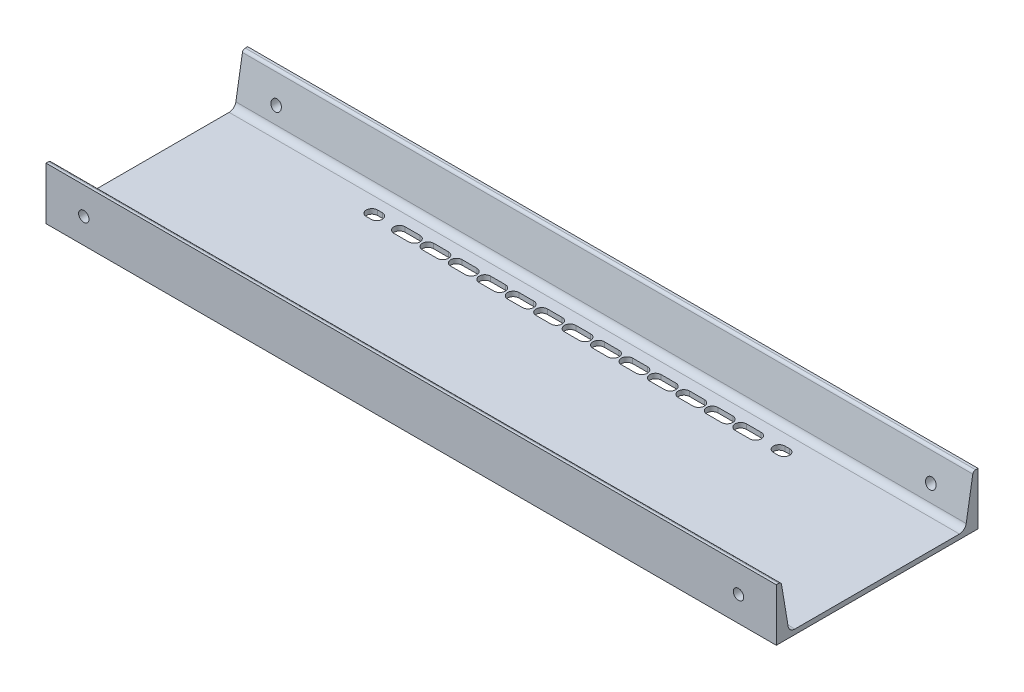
SolidWorks part; units mm, degrees
ref_plane "Front Plane" through (0, 0, 0) normal (1, 0, 0) x (0, 1, 0)
ref_plane "Top Plane" through (0, 0, 0) normal (0, 0, 1) x (0, 1, 0)
ref_plane "Right Plane" through (0, 0, 0) normal (0, 1, 0) x (-1, 0, 0)
sketch "sk0 C10 x 15.3" plane through (0, 0, 0) normal (1, 0, 0) x (0, 1, 0)
  point P0 (-16.0851, 127)
  line B0 (-16.0851, -127) -> (-16.0851, 127)
  line B1 (-16.0851, 127) -> (49.9549, 127)
  line B2 (-16.0851, -127) -> (49.9549, -127)
  line B3 (-16.0851, 0) -> (0, 0) construction
  line B4 (-9.9891, 103.6142) -> (-9.9891, -103.6142)
  line B5 (49.9549, 127) -> (49.9549, 123.9336)
  line B6 (49.9549, -127) -> (49.9549, -123.9336)
  line B7 (-2.7729, 112.1327) -> (46.9836, 120.426)
  line B8 (-2.7729, -112.1327) -> (46.9836, -120.426)
  arc B9 (-9.9891, -103.6142) -> (-2.7729, -112.1327) centre (-1.3531, -103.6142) ccw
  arc B10 (-9.9891, 103.6142) -> (-2.7729, 112.1327) centre (-1.3531, 103.6142) cw
  arc B11 (49.9549, 123.9336) -> (46.9836, 120.426) centre (46.3989, 123.9336) cw
  arc B12 (49.9549, -123.9336) -> (46.9836, -120.426) centre (46.3989, -123.9336) ccw
sketch_block_instance "C10 x 15.3-4"
sketch_block "C10 x 15.3" parameters "D3"=8.636, "D6"=3.556, "D1"=254, "D2"=66.04, "D4"=6.096, "D5"=9.463, "D7"=3.0664, "D8"=16.0851
sketch "sk2 C10 x 15.3" plane through (0, 0, 0) normal (1, 0, 0) x (0, 1, 0)
  line B0 (-16.0851, -127) -> (-16.0851, 127)
  line B1 (-16.0851, 127) -> (49.9549, 127)
  line B2 (-16.0851, -127) -> (49.9549, -127)
  line B3 (-16.0851, 0) -> (0, 0) construction
  line B4 (-9.9891, 103.6142) -> (-9.9891, -103.6142)
  line B5 (49.9549, 127) -> (49.9549, 123.9336)
  line B6 (49.9549, -127) -> (49.9549, -123.9336)
  line B7 (-2.7729, 112.1327) -> (46.9836, 120.426)
  line B8 (-2.7729, -112.1327) -> (46.9836, -120.426)
  arc B9 (-9.9891, -103.6142) -> (-2.7729, -112.1327) centre (-1.3531, -103.6142) ccw
  arc B10 (-9.9891, 103.6142) -> (-2.7729, 112.1327) centre (-1.3531, 103.6142) cw
  arc B11 (49.9549, 123.9336) -> (46.9836, 120.426) centre (46.3989, 123.9336) cw
  arc B12 (49.9549, -123.9336) -> (46.9836, -120.426) centre (46.3989, -123.9336) ccw
sketch_block_instance "C10 x 15.3-3"
sketch "sk C10 x 15.3" plane through (0, 0, 0) normal (1, 0, 0) x (0, 1, 0)
  line B0 (-16.0851, -127) -> (-16.0851, 127)
  line B1 (-16.0851, 127) -> (49.9549, 127)
  line B2 (-16.0851, -127) -> (49.9549, -127)
  line B3 (-16.0851, 0) -> (0, 0) construction
  line B4 (-9.9891, 103.6142) -> (-9.9891, -103.6142)
  line B5 (49.9549, 127) -> (49.9549, 123.9336)
  line B6 (49.9549, -127) -> (49.9549, -123.9336)
  line B7 (-2.7729, 112.1327) -> (46.9836, 120.426)
  line B8 (-2.7729, -112.1327) -> (46.9836, -120.426)
  arc B9 (-9.9891, -103.6142) -> (-2.7729, -112.1327) centre (-1.3531, -103.6142) ccw
  arc B10 (-9.9891, 103.6142) -> (-2.7729, 112.1327) centre (-1.3531, 103.6142) cw
  arc B11 (49.9549, 123.9336) -> (46.9836, 120.426) centre (46.3989, 123.9336) cw
  arc B12 (49.9549, -123.9336) -> (46.9836, -120.426) centre (46.3989, -123.9336) ccw
sketch_block_instance "C10 x 15.3-2"
sketch "sk Bolt pat" plane through (0, 0, 0) normal (0, 1, 0) x (-1, 0, 0)
  line L0 (0, -82.55) -> (0, 82.55) construction
  point P2 (0, 0)
  circle B0 centre (0, -82.55) radius 7.1438
  circle B1 centre (0, 82.55) radius 7.1438
sketch_block_instance "Bolt pat-1"
sketch_block "Bolt pat" parameters "D1"=19.0707, "D2"=20.4939
sketch "sk Bolt Pattern North South" plane through (0, 0, 0) normal (0, 1, 0) x (-1, 0, 0)
  line B0 (-4.6, 82.55) -> (4.6, 82.55) construction
  line B1 (315.0083, 89.6937) -> (321.0083, 89.6937)
  line B2 (315.0083, 75.4063) -> (321.0083, 75.4063)
  line B3 (266.672, 89.6938) -> (275.872, 89.6938)
  line B4 (266.672, 75.4063) -> (275.872, 75.4063)
  line B5 (221.46, 89.6938) -> (230.66, 89.6938)
  line B6 (221.46, 75.4063) -> (230.66, 75.4063)
  line B7 (176.248, 89.6938) -> (185.448, 89.6938)
  line B8 (176.248, 75.4063) -> (185.448, 75.4063)
  line B9 (131.036, 89.6938) -> (140.236, 89.6938)
  line B10 (131.036, 75.4063) -> (140.236, 75.4063)
  line B11 (85.824, 89.6938) -> (95.024, 89.6938)
  line B12 (85.824, 75.4063) -> (95.024, 75.4063)
  line B13 (40.612, 89.6938) -> (49.812, 89.6938)
  line B14 (40.612, 75.4063) -> (49.812, 75.4063)
  line B15 (-4.6, 89.6938) -> (4.6, 89.6938)
  line B16 (-4.6, 75.4062) -> (4.6, 75.4062)
  line B17 (-49.812, 89.6938) -> (-40.612, 89.6938)
  line B18 (-49.812, 75.4062) -> (-40.612, 75.4062)
  line B19 (-95.024, 89.6938) -> (-85.824, 89.6938)
  line B20 (-95.024, 75.4062) -> (-85.824, 75.4062)
  line B21 (-140.236, 89.6938) -> (-131.036, 89.6938)
  line B22 (-140.236, 75.4062) -> (-131.036, 75.4062)
  line B23 (-185.448, 89.6938) -> (-176.248, 89.6938)
  line B24 (-185.448, 75.4062) -> (-176.248, 75.4062)
  line B25 (-230.66, 89.6938) -> (-221.46, 89.6938)
  line B26 (-230.66, 75.4062) -> (-221.46, 75.4062)
  line B27 (-275.872, 89.6937) -> (-266.672, 89.6937)
  line B28 (-275.872, 75.4062) -> (-266.672, 75.4062)
  line B29 (-321.0083, 89.6938) -> (-315.0083, 89.6938)
  line B30 (-321.0083, 75.4063) -> (-315.0083, 75.4063)
  arc B31 (315.0083, 89.6937) -> (315.0083, 75.4063) centre (315.0083, 82.55) ccw
  arc B32 (321.0083, 75.4063) -> (321.0083, 89.6937) centre (321.0083, 82.55) ccw
  arc B33 (266.672, 89.6938) -> (266.672, 75.4063) centre (266.672, 82.55) ccw
  arc B34 (275.872, 75.4063) -> (275.872, 89.6938) centre (275.872, 82.55) ccw
  arc B35 (221.46, 89.6938) -> (221.46, 75.4063) centre (221.46, 82.55) ccw
  arc B36 (230.66, 75.4063) -> (230.66, 89.6938) centre (230.66, 82.55) ccw
  arc B37 (176.248, 89.6938) -> (176.248, 75.4063) centre (176.248, 82.55) ccw
  arc B38 (185.448, 75.4063) -> (185.448, 89.6938) centre (185.448, 82.55) ccw
  arc B39 (131.036, 89.6938) -> (131.036, 75.4063) centre (131.036, 82.55) ccw
  arc B40 (140.236, 75.4063) -> (140.236, 89.6938) centre (140.236, 82.55) ccw
  arc B41 (85.824, 89.6938) -> (85.824, 75.4063) centre (85.824, 82.55) ccw
  arc B42 (95.024, 75.4063) -> (95.024, 89.6938) centre (95.024, 82.55) ccw
  arc B43 (40.612, 89.6938) -> (40.612, 75.4063) centre (40.612, 82.55) ccw
  arc B44 (49.812, 75.4063) -> (49.812, 89.6938) centre (49.812, 82.55) ccw
  arc B45 (-4.6, 89.6938) -> (-4.6, 75.4062) centre (-4.6, 82.55) ccw
  arc B46 (4.6, 75.4062) -> (4.6, 89.6938) centre (4.6, 82.55) ccw
  arc B47 (-49.812, 89.6938) -> (-49.812, 75.4062) centre (-49.812, 82.55) ccw
  arc B48 (-40.612, 75.4062) -> (-40.612, 89.6938) centre (-40.612, 82.55) ccw
  arc B49 (-95.024, 89.6938) -> (-95.024, 75.4062) centre (-95.024, 82.55) ccw
  arc B50 (-85.824, 75.4062) -> (-85.824, 89.6938) centre (-85.824, 82.55) ccw
  arc B51 (-140.236, 89.6938) -> (-140.236, 75.4062) centre (-140.236, 82.55) ccw
  arc B52 (-131.036, 75.4062) -> (-131.036, 89.6938) centre (-131.036, 82.55) ccw
  arc B53 (-185.448, 89.6938) -> (-185.448, 75.4062) centre (-185.448, 82.55) ccw
  arc B54 (-176.248, 75.4062) -> (-176.248, 89.6938) centre (-176.248, 82.55) ccw
  arc B55 (-230.66, 89.6938) -> (-230.66, 75.4062) centre (-230.66, 82.55) ccw
  arc B56 (-221.46, 75.4062) -> (-221.46, 89.6938) centre (-221.46, 82.55) ccw
  arc B57 (-275.872, 89.6937) -> (-275.872, 75.4062) centre (-275.872, 82.55) ccw
  arc B58 (-266.672, 75.4062) -> (-266.672, 89.6937) centre (-266.672, 82.55) ccw
  arc B59 (-321.0083, 89.6938) -> (-321.0083, 75.4063) centre (-321.0083, 82.55) ccw
  arc B60 (-315.0083, 75.4063) -> (-315.0083, 89.6938) centre (-315.0083, 82.55) ccw
  line B61 (-4.6, -82.55) -> (4.6, -82.55) construction
  line B62 (315.0083, -75.4063) -> (321.0083, -75.4063)
  line B63 (315.0083, -89.6937) -> (321.0083, -89.6937)
  line B64 (266.672, -75.4062) -> (275.872, -75.4062)
  line B65 (266.672, -89.6937) -> (275.872, -89.6937)
  line B66 (221.46, -75.4062) -> (230.66, -75.4062)
  line B67 (221.46, -89.6937) -> (230.66, -89.6937)
  line B68 (176.248, -75.4062) -> (185.448, -75.4062)
  line B69 (176.248, -89.6937) -> (185.448, -89.6937)
  line B70 (131.036, -75.4062) -> (140.236, -75.4062)
  line B71 (131.036, -89.6937) -> (140.236, -89.6937)
  line B72 (85.824, -75.4062) -> (95.024, -75.4062)
  line B73 (85.824, -89.6937) -> (95.024, -89.6937)
  line B74 (40.612, -75.4062) -> (49.812, -75.4062)
  line B75 (40.612, -89.6937) -> (49.812, -89.6937)
  line B76 (-4.6, -75.4062) -> (4.6, -75.4062)
  line B77 (-4.6, -89.6938) -> (4.6, -89.6938)
  line B78 (-49.812, -75.4062) -> (-40.612, -75.4062)
  line B79 (-49.812, -89.6938) -> (-40.612, -89.6938)
  line B80 (-95.024, -75.4062) -> (-85.824, -75.4062)
  line B81 (-95.024, -89.6938) -> (-85.824, -89.6938)
  line B82 (-140.236, -75.4062) -> (-131.036, -75.4062)
  line B83 (-140.236, -89.6938) -> (-131.036, -89.6938)
  line B84 (-185.448, -75.4062) -> (-176.248, -75.4062)
  line B85 (-185.448, -89.6938) -> (-176.248, -89.6938)
  line B86 (-230.66, -75.4062) -> (-221.46, -75.4062)
  line B87 (-230.66, -89.6938) -> (-221.46, -89.6938)
  line B88 (-275.872, -75.4063) -> (-266.672, -75.4063)
  line B89 (-275.872, -89.6938) -> (-266.672, -89.6938)
  line B90 (-321.0083, -75.4062) -> (-315.0083, -75.4062)
  line B91 (-321.0083, -89.6937) -> (-315.0083, -89.6937)
  arc B92 (315.0083, -75.4063) -> (315.0083, -89.6937) centre (315.0083, -82.55) ccw
  arc B93 (321.0083, -89.6937) -> (321.0083, -75.4063) centre (321.0083, -82.55) ccw
  arc B94 (266.672, -75.4062) -> (266.672, -89.6937) centre (266.672, -82.55) ccw
  arc B95 (275.872, -89.6937) -> (275.872, -75.4062) centre (275.872, -82.55) ccw
  arc B96 (221.46, -75.4062) -> (221.46, -89.6937) centre (221.46, -82.55) ccw
  arc B97 (230.66, -89.6937) -> (230.66, -75.4062) centre (230.66, -82.55) ccw
  arc B98 (176.248, -75.4062) -> (176.248, -89.6937) centre (176.248, -82.55) ccw
  arc B99 (185.448, -89.6937) -> (185.448, -75.4062) centre (185.448, -82.55) ccw
  arc B100 (131.036, -75.4062) -> (131.036, -89.6937) centre (131.036, -82.55) ccw
  arc B101 (140.236, -89.6937) -> (140.236, -75.4062) centre (140.236, -82.55) ccw
  arc B102 (85.824, -75.4062) -> (85.824, -89.6937) centre (85.824, -82.55) ccw
  arc B103 (95.024, -89.6937) -> (95.024, -75.4062) centre (95.024, -82.55) ccw
  arc B104 (40.612, -75.4062) -> (40.612, -89.6937) centre (40.612, -82.55) ccw
  arc B105 (49.812, -89.6937) -> (49.812, -75.4062) centre (49.812, -82.55) ccw
  arc B106 (-4.6, -75.4062) -> (-4.6, -89.6938) centre (-4.6, -82.55) ccw
  arc B107 (4.6, -89.6938) -> (4.6, -75.4062) centre (4.6, -82.55) ccw
  arc B108 (-49.812, -75.4062) -> (-49.812, -89.6938) centre (-49.812, -82.55) ccw
  arc B109 (-40.612, -89.6938) -> (-40.612, -75.4062) centre (-40.612, -82.55) ccw
  arc B110 (-95.024, -75.4062) -> (-95.024, -89.6938) centre (-95.024, -82.55) ccw
  arc B111 (-85.824, -89.6938) -> (-85.824, -75.4062) centre (-85.824, -82.55) ccw
  arc B112 (-140.236, -75.4062) -> (-140.236, -89.6938) centre (-140.236, -82.55) ccw
  arc B113 (-131.036, -89.6938) -> (-131.036, -75.4062) centre (-131.036, -82.55) ccw
  arc B114 (-185.448, -75.4062) -> (-185.448, -89.6938) centre (-185.448, -82.55) ccw
  arc B115 (-176.248, -89.6938) -> (-176.248, -75.4062) centre (-176.248, -82.55) ccw
  arc B116 (-230.66, -75.4062) -> (-230.66, -89.6938) centre (-230.66, -82.55) ccw
  arc B117 (-221.46, -89.6938) -> (-221.46, -75.4062) centre (-221.46, -82.55) ccw
  arc B118 (-275.872, -75.4063) -> (-275.872, -89.6938) centre (-275.872, -82.55) ccw
  arc B119 (-266.672, -89.6938) -> (-266.672, -75.4063) centre (-266.672, -82.55) ccw
  arc B120 (-321.0083, -75.4062) -> (-321.0083, -89.6937) centre (-321.0083, -82.55) ccw
  arc B121 (-315.0083, -89.6937) -> (-315.0083, -75.4062) centre (-315.0083, -82.55) ccw
sketch_block_instance "Bolt Pattern North South-1"
sketch_block "Bolt Pattern North South" parameters "D1"=7.1437, "D4"=7.1437, "D2"=6, "D3"=9.2, "D5"=6
sketch_block_instance "Bolt Pattern North South-2"
sketch "sk Bolt Pattern East West" plane through (0, 0, 0) normal (0, 1, 0) x (-1, 0, 0)
  line B0 (-9.3, 82.55) -> (9.3, 82.55) construction
  arc B1 (-253.9215, 75.4063) -> (-253.9215, 89.6937) centre (-253.9215, 82.55) ccw
  line B2 (-259.9215, 89.6937) -> (-253.9215, 89.6937)
  line B3 (-259.9215, 75.4063) -> (-253.9215, 75.4063)
  line B4 (253.9215, 88.7273) -> (259.9215, 88.7273)
  line B5 (253.9215, 74.4398) -> (259.9215, 74.4398)
  line B6 (-224.184, 89.6937) -> (-205.584, 89.6937)
  line B7 (-224.184, 75.4063) -> (-205.584, 75.4063)
  line B8 (-188.37, 89.6937) -> (-169.77, 89.6937)
  line B9 (-188.37, 75.4063) -> (-169.77, 75.4063)
  line B10 (-152.556, 89.6937) -> (-133.956, 89.6937)
  line B11 (-152.556, 75.4063) -> (-133.956, 75.4063)
  line B12 (-116.742, 82.55) -> (-98.142, 82.55) construction
  line B13 (-116.742, 89.6937) -> (-98.142, 89.6937)
  line B14 (-116.742, 75.4063) -> (-98.142, 75.4063)
  line B15 (-80.928, 89.6937) -> (-62.328, 89.6937)
  line B16 (-80.928, 75.4063) -> (-62.328, 75.4063)
  line B17 (-45.114, 89.6937) -> (-26.514, 89.6937)
  line B18 (-45.114, 75.4063) -> (-26.514, 75.4063)
  line B19 (-9.3, 89.6937) -> (9.3, 89.6937)
  line B20 (-9.3, 75.4063) -> (9.3, 75.4063)
  line B21 (26.514, 89.6937) -> (45.114, 89.6937)
  line B22 (26.514, 75.4063) -> (45.114, 75.4063)
  line B23 (62.328, 89.6937) -> (80.928, 89.6937)
  line B24 (62.328, 75.4063) -> (80.928, 75.4063)
  line B25 (98.142, 89.6937) -> (116.742, 89.6937)
  line B26 (98.142, 75.4063) -> (116.742, 75.4063)
  line B27 (133.956, 89.6937) -> (152.556, 89.6937)
  line B28 (133.956, 75.4063) -> (152.556, 75.4063)
  line B29 (169.77, 89.6937) -> (188.37, 89.6937)
  line B30 (169.77, 75.4063) -> (188.37, 75.4063)
  line B31 (205.584, 89.6937) -> (224.184, 89.6937)
  line B32 (205.584, 75.4063) -> (224.184, 75.4063)
  arc B33 (-259.9215, 89.6937) -> (-259.9215, 75.4063) centre (-259.9215, 82.55) ccw
  arc B34 (253.9215, 88.7273) -> (253.9215, 74.4398) centre (253.9215, 81.5836) ccw
  arc B35 (259.9215, 74.4398) -> (259.9215, 88.7273) centre (259.9215, 81.5836) ccw
  arc B36 (-224.184, 89.6937) -> (-224.184, 75.4063) centre (-224.184, 82.55) ccw
  arc B37 (-205.584, 75.4063) -> (-205.584, 89.6937) centre (-205.584, 82.55) ccw
  arc B38 (-188.37, 89.6937) -> (-188.37, 75.4063) centre (-188.37, 82.55) ccw
  arc B39 (-169.77, 75.4063) -> (-169.77, 89.6937) centre (-169.77, 82.55) ccw
  arc B40 (-152.556, 89.6937) -> (-152.556, 75.4063) centre (-152.556, 82.55) ccw
  arc B41 (-133.956, 75.4063) -> (-133.956, 89.6937) centre (-133.956, 82.55) ccw
  arc B42 (-116.742, 89.6937) -> (-116.742, 75.4063) centre (-116.742, 82.55) ccw
  arc B43 (-98.142, 75.4063) -> (-98.142, 89.6937) centre (-98.142, 82.55) ccw
  arc B44 (-80.928, 89.6937) -> (-80.928, 75.4063) centre (-80.928, 82.55) ccw
  arc B45 (-62.328, 75.4063) -> (-62.328, 89.6937) centre (-62.328, 82.55) ccw
  arc B46 (-45.114, 89.6937) -> (-45.114, 75.4063) centre (-45.114, 82.55) ccw
  arc B47 (-26.514, 75.4063) -> (-26.514, 89.6937) centre (-26.514, 82.55) ccw
  arc B48 (-9.3, 89.6937) -> (-9.3, 75.4063) centre (-9.3, 82.55) ccw
  arc B49 (9.3, 75.4063) -> (9.3, 89.6937) centre (9.3, 82.55) ccw
  arc B50 (26.514, 89.6937) -> (26.514, 75.4063) centre (26.514, 82.55) ccw
  arc B51 (45.114, 75.4063) -> (45.114, 89.6937) centre (45.114, 82.55) ccw
  arc B52 (62.328, 89.6937) -> (62.328, 75.4063) centre (62.328, 82.55) ccw
  arc B53 (80.928, 75.4063) -> (80.928, 89.6937) centre (80.928, 82.55) ccw
  arc B54 (98.142, 89.6937) -> (98.142, 75.4063) centre (98.142, 82.55) ccw
  arc B55 (116.742, 75.4063) -> (116.742, 89.6937) centre (116.742, 82.55) ccw
  arc B56 (133.956, 89.6937) -> (133.956, 75.4063) centre (133.956, 82.55) ccw
  arc B57 (152.556, 75.4063) -> (152.556, 89.6937) centre (152.556, 82.55) ccw
  arc B58 (169.77, 89.6937) -> (169.77, 75.4063) centre (169.77, 82.55) ccw
  arc B59 (188.37, 75.4063) -> (188.37, 89.6937) centre (188.37, 82.55) ccw
  arc B60 (205.584, 89.6937) -> (205.584, 75.4063) centre (205.584, 82.55) ccw
  arc B61 (224.184, 75.4063) -> (224.184, 89.6937) centre (224.184, 82.55) ccw
  line B62 (-9.3, -82.55) -> (9.3, -82.55) construction
  arc B63 (-253.9215, -89.6937) -> (-253.9215, -75.4063) centre (-253.9215, -82.55) ccw
  line B64 (-259.9215, -75.4063) -> (-253.9215, -75.4063)
  line B65 (-259.9215, -89.6937) -> (-253.9215, -89.6937)
  line B66 (253.9215, -76.3727) -> (259.9215, -76.3727)
  line B67 (253.9215, -90.6602) -> (259.9215, -90.6602)
  line B68 (-224.184, -75.4063) -> (-205.584, -75.4063)
  line B69 (-224.184, -89.6937) -> (-205.584, -89.6937)
  line B70 (-188.37, -75.4063) -> (-169.77, -75.4063)
  line B71 (-188.37, -89.6937) -> (-169.77, -89.6937)
  line B72 (-152.556, -75.4063) -> (-133.956, -75.4063)
  line B73 (-152.556, -89.6937) -> (-133.956, -89.6937)
  line B74 (-116.742, -75.4063) -> (-98.142, -75.4063)
  line B75 (-116.742, -89.6937) -> (-98.142, -89.6937)
  line B76 (-80.928, -75.4063) -> (-62.328, -75.4063)
  line B77 (-80.928, -89.6937) -> (-62.328, -89.6937)
  line B78 (-45.114, -75.4063) -> (-26.514, -75.4063)
  line B79 (-45.114, -89.6937) -> (-26.514, -89.6937)
  line B80 (-9.3, -75.4063) -> (9.3, -75.4063)
  line B81 (-9.3, -89.6937) -> (9.3, -89.6937)
  line B82 (26.514, -75.4063) -> (45.114, -75.4063)
  line B83 (26.514, -89.6937) -> (45.114, -89.6937)
  line B84 (62.328, -75.4063) -> (80.928, -75.4063)
  line B85 (62.328, -89.6937) -> (80.928, -89.6937)
  line B86 (98.142, -75.4063) -> (116.742, -75.4063)
  line B87 (98.142, -89.6937) -> (116.742, -89.6937)
  line B88 (133.956, -75.4063) -> (152.556, -75.4063)
  line B89 (133.956, -89.6937) -> (152.556, -89.6937)
  line B90 (169.77, -75.4063) -> (188.37, -75.4063)
  line B91 (169.77, -89.6937) -> (188.37, -89.6937)
  line B92 (205.584, -75.4063) -> (224.184, -75.4063)
  line B93 (205.584, -89.6937) -> (224.184, -89.6937)
  arc B94 (-259.9215, -75.4063) -> (-259.9215, -89.6937) centre (-259.9215, -82.55) ccw
  arc B95 (253.9215, -76.3727) -> (253.9215, -90.6602) centre (253.9215, -83.5164) ccw
  arc B96 (259.9215, -90.6602) -> (259.9215, -76.3727) centre (259.9215, -83.5164) ccw
  arc B97 (-224.184, -75.4063) -> (-224.184, -89.6937) centre (-224.184, -82.55) ccw
  arc B98 (-205.584, -89.6937) -> (-205.584, -75.4063) centre (-205.584, -82.55) ccw
  arc B99 (-188.37, -75.4063) -> (-188.37, -89.6937) centre (-188.37, -82.55) ccw
  arc B100 (-169.77, -89.6937) -> (-169.77, -75.4063) centre (-169.77, -82.55) ccw
  arc B101 (-152.556, -75.4063) -> (-152.556, -89.6937) centre (-152.556, -82.55) ccw
  arc B102 (-133.956, -89.6937) -> (-133.956, -75.4063) centre (-133.956, -82.55) ccw
  arc B103 (-116.742, -75.4063) -> (-116.742, -89.6937) centre (-116.742, -82.55) ccw
  arc B104 (-98.142, -89.6937) -> (-98.142, -75.4063) centre (-98.142, -82.55) ccw
  arc B105 (-80.928, -75.4063) -> (-80.928, -89.6937) centre (-80.928, -82.55) ccw
  arc B106 (-62.328, -89.6937) -> (-62.328, -75.4063) centre (-62.328, -82.55) ccw
  arc B107 (-45.114, -75.4063) -> (-45.114, -89.6937) centre (-45.114, -82.55) ccw
  arc B108 (-26.514, -89.6937) -> (-26.514, -75.4063) centre (-26.514, -82.55) ccw
  arc B109 (-9.3, -75.4063) -> (-9.3, -89.6937) centre (-9.3, -82.55) ccw
  arc B110 (9.3, -89.6937) -> (9.3, -75.4063) centre (9.3, -82.55) ccw
  arc B111 (26.514, -75.4063) -> (26.514, -89.6937) centre (26.514, -82.55) ccw
  arc B112 (45.114, -89.6937) -> (45.114, -75.4063) centre (45.114, -82.55) ccw
  arc B113 (62.328, -75.4063) -> (62.328, -89.6937) centre (62.328, -82.55) ccw
  arc B114 (80.928, -89.6937) -> (80.928, -75.4063) centre (80.928, -82.55) ccw
  arc B115 (98.142, -75.4063) -> (98.142, -89.6937) centre (98.142, -82.55) ccw
  arc B116 (116.742, -89.6937) -> (116.742, -75.4063) centre (116.742, -82.55) ccw
  arc B117 (133.956, -75.4063) -> (133.956, -89.6937) centre (133.956, -82.55) ccw
  arc B118 (152.556, -89.6937) -> (152.556, -75.4063) centre (152.556, -82.55) ccw
  arc B119 (169.77, -75.4063) -> (169.77, -89.6937) centre (169.77, -82.55) ccw
  arc B120 (188.37, -89.6937) -> (188.37, -75.4063) centre (188.37, -82.55) ccw
  arc B121 (205.584, -75.4063) -> (205.584, -89.6937) centre (205.584, -82.55) ccw
  arc B122 (224.184, -89.6937) -> (224.184, -75.4063) centre (224.184, -82.55) ccw
sketch_block_instance "Bolt Pattern East West-2"
sketch_block "Bolt Pattern East West" parameters "D1"=7.1437, "D2"=6, "D3"=6, "D4"=18.6
sketch_block_instance "Bolt Pattern East West-3"
extrude "beam E W" add sketch "sk C10 x 15.3" along normal mid plane 919.83
extrude "beam N S" [suppressed] add sketch "sk2 C10 x 15.3" along normal mid plane 968.248 separate body
extrude "E W bolt holes" cut sketch "sk Bolt Pattern East West" against normal through all
extrude "N S bolt holes" [suppressed] cut sketch "sk Bolt Pattern North South" against normal through all
sketch "Sketch3" plane through (0, 0, 0) normal (0, 0, 1) x (0, 1, 0)
  circle A0 centre (15.6649, 412.29) radius 6.5484
  circle A1 centre (15.6649, -412.29) radius 6.5484
  dimension "D2" = 13.0969
  dimension "D3" = 13.0969
  dimension "D1" = 31.75
  dimension "D4" = 412.29
  dimension "D5" = 412.29
extrude "Pin holes 1" cut sketch "Sketch3" against normal through all both and the other way through all
sketch "Sketch4" [suppressed] plane through (0, 0, 0) normal (0, 0, 1) x (0, 1, 0)
  circle A0 centre (15.6649, 452.374) radius 6.5484
  circle A1 centre (15.6649, -452.374) radius 6.5484
  dimension "D2" = 13.0969
  dimension "D3" = 13.0969
  dimension "D1" = 452.374
  dimension "D4" = 31.75
  dimension "D5" = 452.374
extrude "Pin holes 2" [suppressed] cut sketch "Sketch4" against normal through all both and the other way through all
ref_plane "Center bolt 1" through (0, 0, 82.55) normal (0, 0, 1) x (0, -1, 0)
ref_plane "Center bolt 2" through (0, 0, -82.55) normal (0, 0, 1) x (0, -1, 0)
